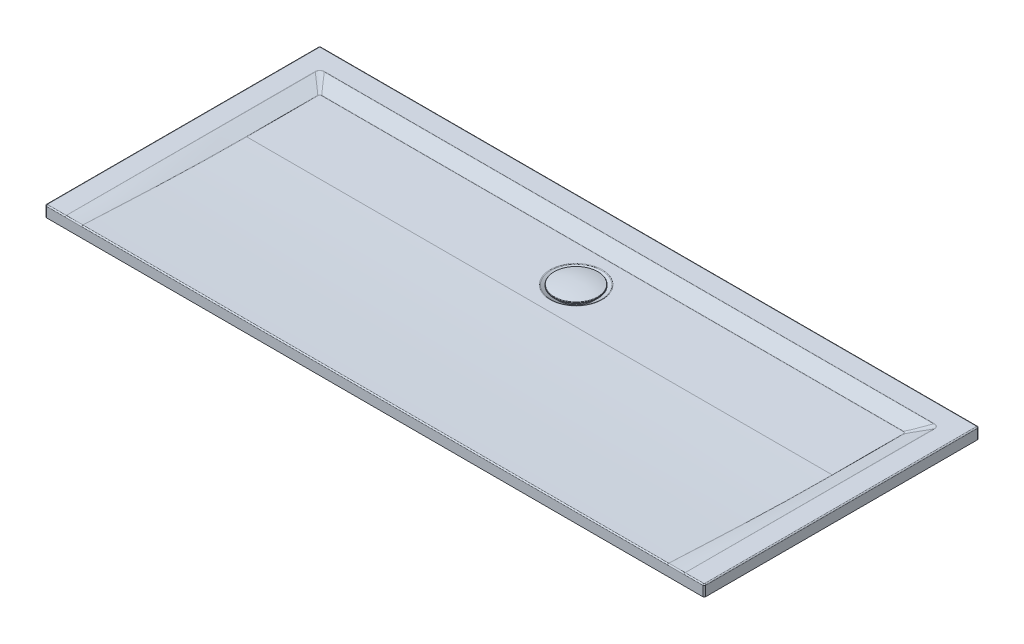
SolidWorks part; units mm, degrees
ref_plane "Płaszczyzna przednia" through (0, 0, 0) normal (0, 0, 1) x (1, 0, 0)
ref_plane "Płaszczyzna górna" through (0, 0, 0) normal (0, 1, 0) x (1, 0, 0)
ref_plane "Płaszczyzna prawa" through (0, 0, 0) normal (1, 0, 0) x (0, 0, -1)
sketch "Szkic1" plane through (0, 0, 0) normal (0, 1, 0) x (1, 0, 0)
  line L0 (0, 375) -> (0, -375) construction
  line L1 (-900, 375) -> (900, 375)
  line L2 (-900, 375) -> (-900, -375)
  line L3 (-900, -375) -> (900, -375)
  line L4 (900, 375) -> (900, -375)
  line L5 (-845, -375) -> (-845, 320)
  line L6 (-845, 320) -> (845, 320)
  line L7 (845, 320) -> (845, -375)
  line L8 (-800, -375) -> (-800, 275)
  line L9 (-800, 275) -> (800, 275)
  line L10 (800, 275) -> (800, -375)
  circle A0 centre (0, 175) radius 45
  circle A1 centre (0, 175) radius 70
  point P9 (0, 320)
  dimension "D6" = 90
  dimension "D7" = 140
  dimension "D1" = 1800
  dimension "D2" = 55
  dimension "D3" = 55
  dimension "D5" = 200
  dimension "D8" = 750
  dimension "D4" = 45
sketch "Szkic2" plane through (0, 0, 0) normal (0, 1, 0) x (1, 0, 0)
  line L0 (-900, -375) -> (900, -375) construction
  line L1 (900, 375) -> (900, -375) construction
  line L2 (845, 320) -> (845, -375) construction
  line L3 (-845, 320) -> (845, 320) construction
  line L4 (-900, 375) -> (900, 375) construction
  line L5 (-845, -375) -> (-845, 320) construction
  line L6 (-900, 375) -> (-900, -375) construction
  line L7 (-900, -375) -> (-845, -375)
  line L8 (900, 375) -> (900, -375)
  line L9 (845, 320) -> (845, -375)
  line L10 (-845, 320) -> (845, 320)
  line L11 (-900, 375) -> (900, 375)
  line L12 (-845, -375) -> (-845, 320)
  line L13 (-900, 375) -> (-900, -375)
  line L14 (845, -375) -> (900, -375)
surface "Powierzchnia-Płaszczyzna1" sketch "Szkic2"
ref_plane "Płaszczyzna1" through (0, -15, 0) normal (0, 1, 0) x (-1, 0, 0)
sketch "Szkic3" plane through (0, -15, 0) normal (0, 1, 0) x (-1, 0, 0)
  line L0 (800, -75) -> (-800, -75)
  line L1 (800, 375) -> (800, -275) construction
  line L2 (-800, -275) -> (-800, 375) construction
  line L3 (0, -75) -> (0, -275) construction
  line L4 (800, -275) -> (-800, -275) construction
  line L5 (-800, -275) -> (-800, -75)
  line L6 (800, -75) -> (800, -275)
  line L7 (800, -275) -> (-800, -275)
  circle A0 centre (0, -175) radius 70 construction
  circle A1 centre (0, -175) radius 70
  point P10 (0, -175)
surface "Powierzchnia-Płaszczyzna2" sketch "Szkic3"
sketch "Szkic4" plane through (0, 0, 0) normal (0, 1, 0) x (1, 0, 0)
  line L0 (800, -375) -> (-800, -375)
other "Granica-Powierzchnia1"
other "Granica-Powierzchnia2"
other "Granica-Powierzchnia3"
mirror "Lustro1" about plane through (0, 0, 0) normal (1, 0, 0)
sketch "Szkic5" plane through (0, 0, 0) normal (0, 1, 0) x (1, 0, 0)
  line L0 (900, 375) -> (900, -375) construction
  line L1 (-900, 375) -> (900, 375) construction
  line L2 (-900, 375) -> (-900, -375) construction
  line L3 (-900, -375) -> (900, -375) construction
  line L4 (900, 375) -> (900, -375)
  line L5 (-900, 375) -> (900, 375)
  line L6 (-900, 375) -> (-900, -375)
  line L7 (-900, -375) -> (900, -375)
surface "Powierzchnia-Wyciągnięcie1" sketch "Szkic5" parameters "D1"=30
sketch "Szkic7" plane through (0, 0, 0) normal (1, 0, 0) x (0, 0, -1)
  line L0 (175, 0) -> (175, -30) construction
  line L1 (375, -30) -> (-375, -30) construction
  line L2 (220, -30) -> (220, -28)
  line L3 (220, -28) -> (224, -28)
  line L6 (224, -28) -> (245, -15)
  dimension "D1" = 90
  dimension "D2" = 2
  dimension "D3" = 98
surface "Powierzchnia-Obrót wokół linii środkowej1" sketch "Szkic7" parameters "D1"=360
surface "Powierzchnia-Płaszczyzna3"
surface "Powierzchnia-Połącz1"
fillet "Zaokrąglenie1" radius 4 6 edges at (0, -28, -224) (0, -15, -105) (900, -15, 375) (900, -15, -375) (-900, -15, -375) (-900, -15, 375)
fillet "Zmienne zaokrąglenie1" radius 40 2 edges at (822.5, -7.5, -297.5)
fillet "Zaokrąglenie3" radius 3 12 edges
fillet "Zaokrąglenie4" radius 3 12 edges at (-898.8284, 0, -373.8284) (0, 0, -375) (898.8284, 0, -373.8284) (900, 0, 0) (898.8284, 0, 373.8284) (870.5, 0, 375) (-870.5, 0, 375) (-898.8284, 0, 373.8284) (-900, 0, 0)
sketch "Szkic8" plane through (0, 0, 0) normal (1, 0, 0) x (0, 0, -1)
  line L0 (175, 0) -> (175, -30) construction
  line L1 (175, -5.6601) -> (179.8469, -5.6601) construction
  line L2 (235, -14.7573) -> (235, -17)
  line L3 (235, -17) -> (175, -17)
  line L4 (175, -17) -> (175, -5.6601)
  line L5 (175, -5.6601) -> (199.9922, 95.6514)
  arc A0 (175, -5.6601) -> (234.2694, -13.7943) centre (175, -225.6601) cw
  arc A1 (234.2694, -13.7943) -> (235, -14.7573) centre (234, -14.7573) cw
  point P11 (235, -14)
  dimension "D1" = 220
  dimension "D4" = 1
  dimension "D2" = 60
  dimension "D3" = 3
  dimension "D5" = 13
revolve "Obrót wokół linii środkowej1" add sketch "Szkic8" angle 360 about L4
